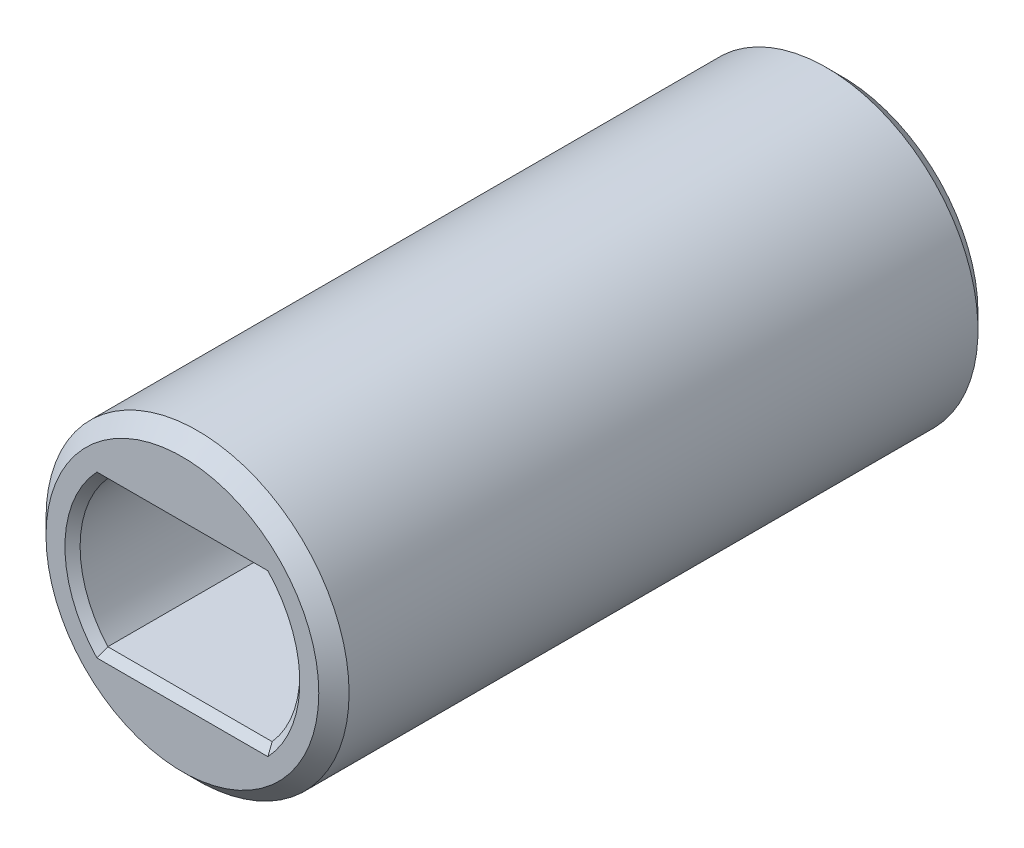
SolidWorks part; units mm, degrees
ref_plane "Přední rovina" through (0, 0, 0) normal (0, 0, 1) x (1, 0, 0)
ref_plane "Horní rovina" through (0, 0, 0) normal (0, 1, 0) x (1, 0, 0)
ref_plane "Pravá rovina" through (0, 0, 0) normal (1, 0, 0) x (0, 0, -1)
sketch "Skica1" plane through (0, 0, 0) normal (0, 0, 1) x (1, 0, 0)
  line L0 (-5.0761, 0) -> (4.8847, 0) construction
  line L1 (-2.169, 1.925) -> (2.169, 1.925)
  line L2 (-2.169, -1.925) -> (2.169, -1.925)
  line L3 (-5.9628, 5.3333) -> (-1.4907, 10.3333) construction
  line L4 (0, 4.24) -> (0, -1.5529) construction
  line L5 (5.9628, 5.3333) -> (1.4907, 10.3333) construction
  arc A0 (-2.169, 1.925) -> (-2.169, -1.925) centre (0, 0) ccw
  arc A1 (2.169, -1.925) -> (2.169, 1.925) centre (0, 0) ccw
  arc A2 (-5.9628, 5.3333) -> (5.9628, 5.3333) centre (0, 0) ccw construction
  arc A3 (1.4907, 10.3333) -> (-1.4907, 10.3333) centre (0, 9) ccw construction
  circle A4 centre (0, 0) radius 4
  dimension "D1" = 2.9
  dimension "D3" = 8
  dimension "D4" = 2
  dimension "D5" = 11
  dimension "D6" = 8
  dimension "D2" = 3.85
extrude "Přidat vysunutím1" add sketch "Skica1" along normal blind 8.4
sketch "Skica2" plane through (0, 0, 0) normal (0, 0, -1) x (-1, 0, 0)
  circle A1 centre (0, 0) radius 4
  circle A2 centre (0, 0) radius 4
  dimension "D1" = 0
extrude "Přidat vysunutím2" add sketch "Skica2" along normal blind 9
sketch "Skica3" plane through (0, 0, -9) normal (0, 0, -1) x (-1, 0, 0)
  circle A0 centre (0, 0) radius 3
  dimension "D1" = 6
extrude "Odebrat vysunutím1" cut sketch "Skica3" against normal blind 8
sketch "Skica4" plane through (0, 0, -1) normal (0, 0, -1) x (-1, 0, 0)
  line L1 (-0.4, -3.9799) -> (0.4, -3.9799)
  line L2 (-0.4, -3.9799) -> (-0.4, 3.9799)
  line L3 (-0.4, 3.9799) -> (0.4, 3.9799)
  line L4 (0.4, -3.9799) -> (0.4, 3.9799)
  line L5 (-0.4, -3.9799) -> (0.4, 3.9799) construction
  line L6 (-0.4, 3.9799) -> (0.4, -3.9799) construction
  circle A0 centre (0, 0) radius 4 construction
  point P0 (0, 0)
  dimension "D1" = 0.8
extrude "Přidat vysunutím3" add sketch "Skica4" along normal blind 6
chamfer "Zkosení1" distance 0.2 angle 45 2 edges at (-0.4, 0, -7) (0.4, 0, -7)
chamfer "Zkosení2" distance 0.2 angle 45 5 edges at (2.9, 0, 8.4) (0, -1.925, 8.4) (0, 1.925, 8.4) (-2.9, 0, 8.4) (-3, 0, -9)
chamfer "Zkosení3" distance 0.4 angle 45 2 edges at (-4, 0, -9) (4, 0, 8.4)
